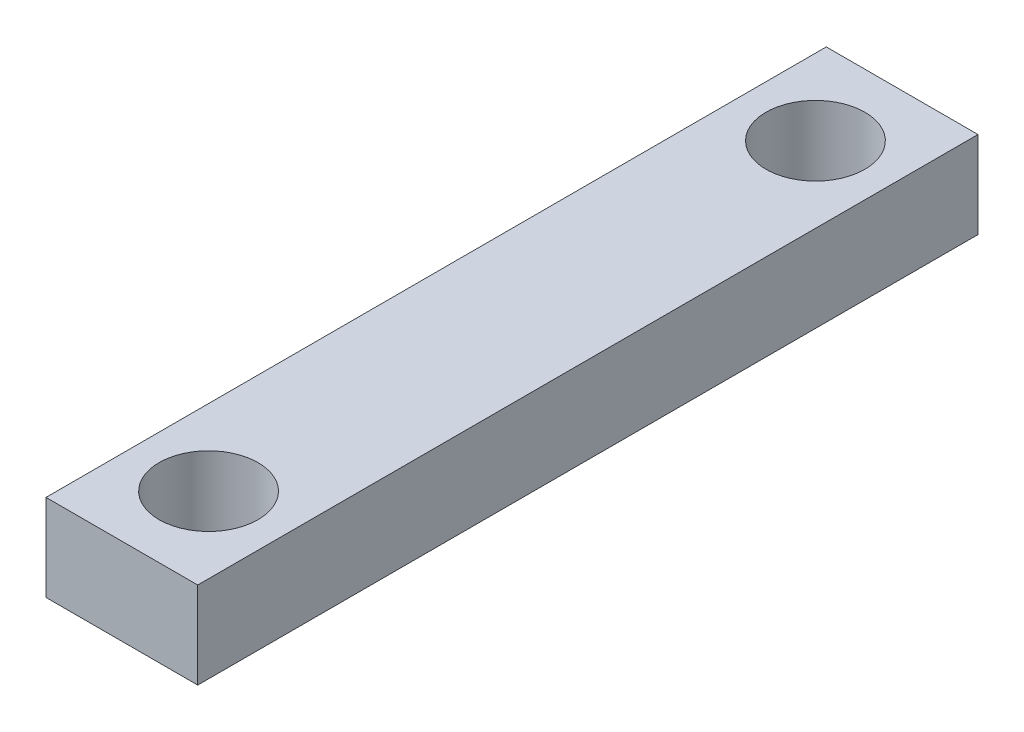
SolidWorks part; units mm, degrees
ref_plane "Front" through (0, 0, 0) normal (0, 0, 1) x (1, 0, 0)
ref_plane "Top" through (0, 0, 0) normal (0, 1, 0) x (1, 0, 0)
ref_plane "Right" through (0, 0, 0) normal (1, 0, 0) x (0, 0, -1)
sketch "Sketch2" plane through (0, 0, 0) normal (0, 1, 0) x (1, 0, 0)
  line L0 (-5.5563, 28.575) -> (5.5562, 28.575) construction
  line L1 (-5.5563, 57.15) -> (5.5562, 57.15)
  line L2 (-5.5563, 57.15) -> (-5.5562, 0)
  line L3 (-5.5562, 0) -> (5.5562, 0)
  line L4 (5.5562, 57.15) -> (5.5562, 0)
  circle A0 centre (0, 6.35) radius 3.6224
  circle A1 centre (0, 50.8) radius 3.6224
  dimension "D1" = 11.1125
  dimension "D2" = 57.15
  dimension "D3" = 6.35
extrude "Extrude1" add sketch "Sketch2" along normal blind 6.35
